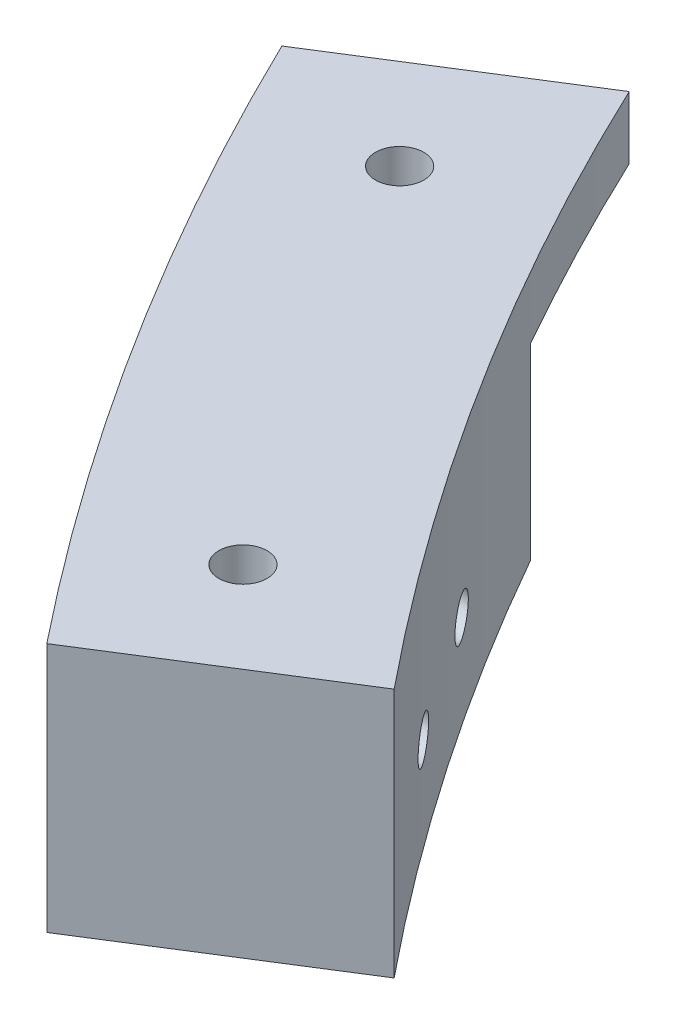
SolidWorks part; units mm, degrees
ref_plane "XY Plane" through (0, 0, 0) normal (0, 0, 1) x (1, 0, 0)
ref_plane "XZ Plane" through (0, 0, 0) normal (0, 1, 0) x (1, 0, 0)
ref_plane "YZ Plane" through (0, 0, 0) normal (1, 0, 0) x (0, 0, -1)
ref_plane "Plane1" through (0, -80.9625, 0) normal (0, -1, 0) x (1, 0, 0)
sketch "Sketch1" plane through (0, -80.9625, 0) normal (0, -1, 0) x (1, 0, 0)
  line L0 (-617.3091, 298.7493) -> (-574.035, 271.4937)
  line L1 (-492.8151, 400.4476) -> (-536.0892, 427.7032)
  arc A0 (-536.0892, 427.7032) -> (-617.3091, 298.7493) centre (0, 0) ccw
  arc A1 (-574.035, 271.4937) -> (-492.8151, 400.4476) centre (0, 0) cw
extrude "Boss-Extrude1" add sketch "Sketch1" against normal blind 50.8
sketch "Sketch2" plane through (0, -80.9625, 0) normal (0, -1, 0) x (1, 0, 0)
  line L0 (-552.45, 313.0878) -> (-552.45, 406.3504)
  line L1 (-617.3091, 298.7493) -> (-574.035, 271.4937)
  arc A0 (-574.035, 271.4937) -> (-552.45, 313.0878) centre (0, 0) cw
  arc A1 (-552.45, 406.3504) -> (-617.3091, 298.7493) centre (0, 0) ccw
extrude "Cut-Extrude1" cut sketch "Sketch2" against normal blind 38.1
hole_wizard "3/8 Clearance Hole1" positions "Sketch4" profile "Sketch3" hole size "3/8" standard "ANSI Inch"
sketch "Sketch4" plane through (0, -80.9625, 0) normal (0, -1, 0) x (-1, 0, 0)
  point P0 (530.071, -393.8945)
sketch "Sketch3" plane through (-530.071, -80.9625, 393.8945) normal (1, 0, 0) x (0, 0, -1)
  line L0 (0, 0) -> (0, 50.8)
  line L1 (0, 50.8) -> (4.9022, 50.8)
  line L2 (4.9022, 50.8) -> (4.9022, 0)
  line L5 (4.9022, 0) -> (0, 0)
  line L11 (0, -6.35) -> (0, 107.95) construction
  dimension "Thru Hole Dia." = 9.8044
  dimension "Thru Hole Depth" = 50.8
hole_wizard "3/8 Clearance Hole2" positions "Sketch6" profile "Sketch5" hole size "3/8" standard "ANSI Inch"
sketch "Sketch6" plane through (0, -30.1625, 0) normal (0, 1, 0) x (1, 0, 0)
  point P0 (-584.2176, -307.9253)
sketch "Sketch5" plane through (-584.2176, -30.1625, 307.9253) normal (1, 0, 0) x (0, 0, 1)
  line L0 (0, 0) -> (0, 50.8)
  line L1 (0, 50.8) -> (4.9022, 50.8)
  line L2 (4.9022, 50.8) -> (4.9022, 0)
  line L5 (4.9022, 0) -> (0, 0)
  line L11 (0, -6.35) -> (0, 107.95) construction
  dimension "Thru Hole Dia." = 9.8044
  dimension "Thru Hole Depth" = 50.8
hole_wizard "3/8-16 Tapped Hole1" positions "Sketch8" profile "Sketch7" tap size "3/8-16" standard "ANSI Inch"
sketch "Sketch8" plane through (-552.45, 0, 0) normal (-1, 0, 0) x (0, 0, 1)
  point P0 (374.65, -61.9125)
sketch "Sketch7" plane through (-552.45, -61.9125, 374.65) normal (0, 1, 0) x (0, 0, 1)
  line L0 (0, 0) -> (0, 59.6349)
  line L1 (0, 59.6349) -> (3.9687, 59.6349)
  line L2 (3.9687, 59.6349) -> (3.9687, 0)
  line L5 (3.9687, 0) -> (0, 0)
  line L11 (0, -6.35) -> (0, 107.95) construction
  dimension "Thread Major Dia." = 7.9375
  dimension "Thru Tap Drill Depth" = 59.6349
hole_wizard "3/8-16 Tapped Hole2" positions "Sketch10" profile "Sketch9" tap size "3/8-16" standard "ANSI Inch"
sketch "Sketch10" plane through (-552.45, 0, 0) normal (-1, 0, 0) x (0, 0, 1)
  point P0 (349.25, -61.9125)
sketch "Sketch9" plane through (-552.45, -61.9125, 349.25) normal (0, 1, 0) x (0, 0, 1)
  line L0 (0, 0) -> (0, 59.6349)
  line L1 (0, 59.6349) -> (3.9687, 59.6349)
  line L2 (3.9687, 59.6349) -> (3.9687, 0)
  line L5 (3.9687, 0) -> (0, 0)
  line L11 (0, -6.35) -> (0, 107.95) construction
  dimension "Thread Major Dia." = 7.9375
  dimension "Thru Tap Drill Depth" = 59.6349
